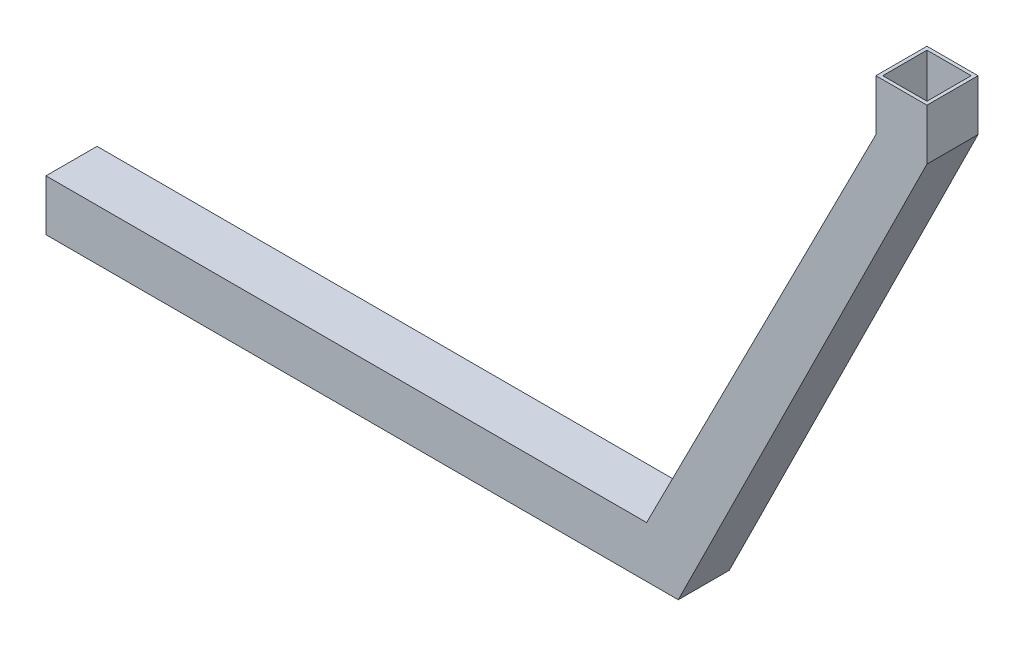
SolidWorks part; units mm, degrees
ref_plane "Plan de face" through (0, 0, 0) normal (0, 0, 1) x (1, 0, 0)
ref_plane "Plan de dessus" through (0, 0, 0) normal (0, 1, 0) x (1, 0, 0)
ref_plane "Plan de droite" through (0, 0, 0) normal (1, 0, 0) x (0, 0, -1)
sketch "Esquisse1" plane through (0, 0, 0) normal (0, 0, 1) x (1, 0, 0)
  line L0 (142.4578, -15) -> (183.7483, -15)
  line L1 (142.4578, -15) -> (-187.8143, -15)
  line L2 (183.7483, -15) -> (329.8857, 279.8)
  line L3 (165.1361, 15) -> (-187.8143, 15)
  line L4 (-187.8143, -15) -> (-187.8143, 15)
  line L5 (299.8857, 279.8) -> (299.8857, 309.8)
  line L6 (299.8857, 309.8) -> (329.8857, 309.8)
  line L8 (299.8857, 279.8) -> (165.1361, 15)
  line L9 (329.8857, 309.8) -> (329.8857, 279.8)
  point P0 (0, 0)
  dimension "D1" = 30
  dimension "D2" = 30
  dimension "D3" = 30
  dimension "D4" = 517.7
  dimension "D5" = 294.8
  dimension "D6" = 30
extrude "Boss.-Extru.1" add sketch "Esquisse1" along normal blind 30
shell "Coque1" thickness 2
sketch "Esquisse2" plane through (-187.8143, 0, 0) normal (-1, 0, 0) x (0, 0, 1)
  line L0 (30, -15) -> (0, -15) construction
  line L1 (28, -13) -> (2, -13)
  line L2 (28, -13) -> (28, 13)
  line L3 (28, 13) -> (2, 13)
  line L4 (2, -13) -> (2, 13)
  line L5 (28, -13) -> (2, 13) construction
  line L6 (28, 13) -> (2, -13) construction
  line L7 (30, 15) -> (0, 15) construction
  line L8 (30, 15) -> (30, -15) construction
  line L9 (0, 15) -> (0, -15) construction
  point P0 (15, 0)
  dimension "D1" = 2
  dimension "D2" = 2
  dimension "D3" = 2
  dimension "D4" = 2
extrude "Enlèv. mat.-Extru.1" cut sketch "Esquisse2" against normal blind 30
